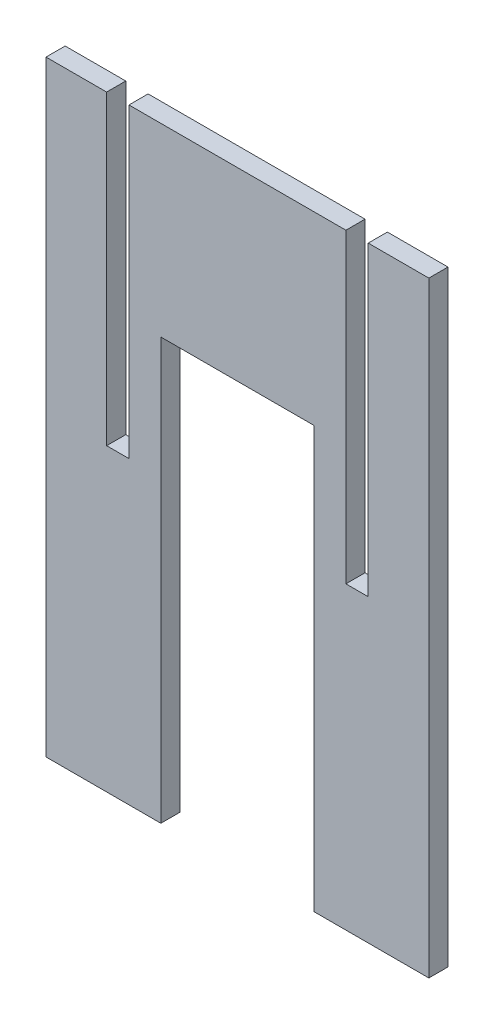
SolidWorks part; units mm, degrees
ref_plane "Plan de face" through (0, 0, 0) normal (0, 0, 1) x (1, 0, 0)
ref_plane "Plan de dessus" through (0, 0, 0) normal (0, 1, 0) x (1, 0, 0)
ref_plane "Plan de droite" through (0, 0, 0) normal (1, 0, 0) x (0, 0, -1)
sketch "Esquisse1" plane through (0, 0, 0) normal (0, 0, 1) x (1, 0, 0)
  line L1 (0, 0) -> (60, 0)
  line L2 (0, 0) -> (0, 95)
  line L3 (0, 95) -> (60, 95)
  line L4 (60, 0) -> (60, 95)
  dimension "D1" = 60
  dimension "D2" = 95
extrude "Extrusion1" add sketch "Esquisse1" along normal blind 3
sketch "Esquisse2" plane through (0, 0, 3) normal (0, 0, 1) x (1, 0, 0)
  line L0 (0, 0) -> (60, 0) construction
  line L1 (18, 0) -> (42, 0)
  line L2 (18, 0) -> (18, 66)
  line L3 (18, 66) -> (42, 66)
  line L4 (42, 0) -> (42, 66)
  dimension "D1" = 24
  dimension "D2" = 18
  dimension "D3" = 66
extrude "Enlèv. mat.-Extru.1" cut sketch "Esquisse2" against normal blind 3
sketch "Esquisse3" plane through (0, 0, 3) normal (0, 0, 1) x (1, 0, 0)
  line L0 (60, 95) -> (0, 95) construction
  line L1 (9.5, 95) -> (13, 95)
  line L2 (9.5, 95) -> (9.5, 47)
  line L3 (9.5, 47) -> (13, 47)
  line L4 (13, 95) -> (13, 47)
  line L6 (47, 95) -> (50.5, 95)
  line L7 (47, 95) -> (47, 47)
  line L8 (47, 47) -> (50.5, 47)
  line L9 (50.5, 95) -> (50.5, 47)
  dimension "D1" = 9.5
  dimension "D2" = 3.5
  dimension "D3" = 48
  dimension "D4" = 3.5
  dimension "D5" = 9.5
  dimension "D6" = 48
extrude "Enlèv. mat.-Extru.2" cut sketch "Esquisse3" against normal blind 3
